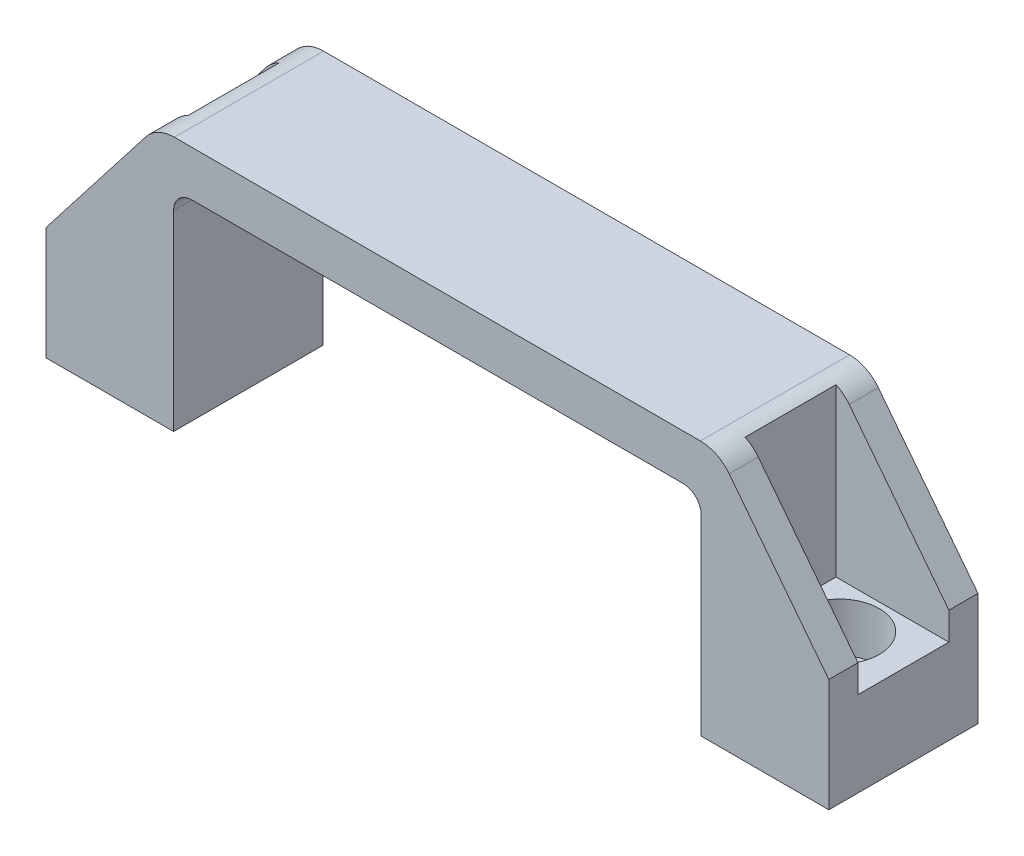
SolidWorks part; units mm, degrees
ref_plane "Front"
ref_plane "Top" through (0, 0, 0) normal (0, 1, 0) x (1, 0, 0)
ref_plane "Right" through (0, 0, 0) normal (1, 0, 0) x (0, 0, -1)
sketch "Sketch1" plane through (0, 0, 0) normal (0, 0, 1) x (1, 0, 0)
  line L0 (0, 0) -> (0, 15.7544)
  line L1 (0, 15.7544) -> (13.9179, 33.6724)
  line L2 (17.9298, 35.6362) -> (54.6481, 35.6362)
  line L3 (54.6481, 35.6362) -> (54.6481, 29.2862)
  line L4 (54.6481, 29.2862) -> (20.3581, 29.2862)
  line L5 (17.8181, 26.7462) -> (17.8181, 0)
  line L6 (17.8181, 0) -> (0, 0)
  arc A0 (20.3581, 29.2862) -> (17.8181, 26.7462) centre (20.3581, 26.7462) ccw
  arc A1 (13.9179, 33.6724) -> (17.9298, 35.6362) centre (17.9298, 30.5562) cw
  point P12 (15.4432, 35.6362)
  dimension "D7" = 2.54
  dimension "D8" = 5.08
  dimension "D1" = 54.6481
  dimension "D2" = 35.6362
  dimension "D3" = 17.8181
  dimension "D4" = 15.7544
  dimension "D5" = 15.4432
  dimension "D6" = 6.35
extrude "Extrude1" add sketch "Sketch1" along normal mid plane 20.828
sketch "Sketch2" plane through (0, 35.6362, 0) normal (0, 1, 0) x (-1, 0, 0)
  line L0 (0, 0) -> (-33.9442, 0) construction
  line L1 (0, 6.35) -> (0, -6.35)
  line L2 (0, 10.414) -> (0, -10.414) construction
  line L3 (0, -6.35) -> (-15.7543, -6.35)
  line L4 (-15.7543, -6.35) -> (-15.7544, 6.35)
  line L5 (0, 6.35) -> (-15.7544, 6.35)
  point P9 (-15.7543, 0)
  dimension "D1" = 12.7
  dimension "D2" = 15.7544
extrude "Cut-Extrude1" cut sketch "Sketch2" against normal blind 23.749
hole_wizard "CBORE for 1/4 Socket Head Cap Screw2" positions "Sketch7" profile "Sketch8" counterbore size "1/4" standard "Ansi Inch"
sketch "Sketch7" plane through (0, 11.8872, 0) normal (0, 1, 0) x (-1, 0, 0)
  line L0 (0, 0) -> (-14.3664, 0) construction
  line L2 (0, -6.35) -> (0, 6.35) construction
  point P0 (-8.9281, 0)
  dimension "D1" = 8.9281
sketch "Sketch8" plane through (8.9281, 11.8872, 0) normal (1, 0, 0) x (0, 0, 1)
  line L0 (0, 0) -> (0, 11.8872)
  line L1 (0, 11.8872) -> (3.3782, 11.8872)
  line L3 (3.3782, 11.8872) -> (3.3782, 6.858)
  line L4 (3.3782, 6.858) -> (5.5562, 6.858)
  line L5 (5.5562, 6.858) -> (5.5562, 0)
  line L7 (5.5562, 0) -> (0, 0)
  line L11 (0, -6.35) -> (0, 107.95) construction
  dimension "Thru Hole Dia." = 6.7564
  dimension "Thru Hole Depth" = 11.8872
  dimension "C'Bore Dia." = 11.1125
  dimension "C'Bore Depth" = 6.858
hole_wizard "CBORE for 5/16 Socket Head Cap Screw1" positions "Sketch4" profile "Sketch3" counterbore size "5/16" standard "Ansi Inch"
sketch "Sketch4" plane through (0, 15.875, 0) normal (0, 1, 0) x (-1, 0, 0)
  line L0 (0, 0) -> (-28.5789, 0) construction
  line L1 (0, 12.954) -> (0, 9.3345) construction
  point P0 (-11.1125, 0)
  point P5 (-11.1125, 0)
  dimension "D1" = 8.9281
sketch "Sketch3" plane through (11.1125, 15.875, 0) normal (1, 0, 0) x (0, 0, 1)
  line L0 (0, 0) -> (0, 15.875)
  line L1 (0, 15.875) -> (4.2164, 15.875)
  line L3 (4.2164, 15.875) -> (4.2164, 8.636)
  line L4 (4.2164, 8.636) -> (6.35, 8.636)
  line L5 (6.35, 8.636) -> (6.35, 0)
  line L7 (6.35, 0) -> (0, 0)
  line L11 (0, -6.35) -> (0, 107.95) construction
  dimension "Thru Hole Dia." = 8.4328
  dimension "Thru Hole Depth" = 15.875
  dimension "C'Bore Dia." = 12.7
  dimension "C'Bore Depth" = 8.636
mirror "Mirror1" about plane through (54.6481, 35.6362, 10.414) normal (-1, 0, 0)
